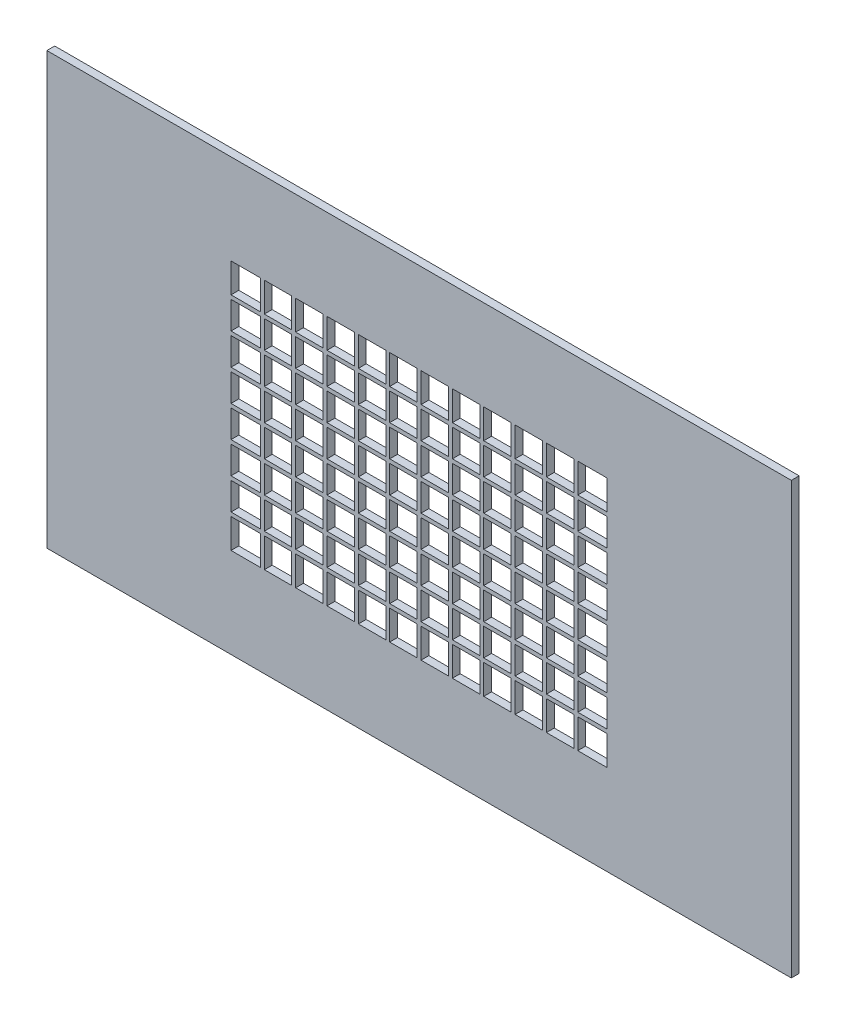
SolidWorks part; units mm, degrees
ref_plane "Front Plane" through (0, 0, 0) normal (0, 0, 1) x (1, 0, 0)
ref_plane "Top Plane" through (0, 0, 0) normal (0, 1, 0) x (1, 0, 0)
ref_plane "Right Plane" through (0, 0, 0) normal (1, 0, 0) x (0, 0, -1)
sketch "Sketch2" plane through (0, 0, 0) normal (0, 0, 1) x (1, 0, 0)
  line L1 (-237.5, -137.5) -> (237.5, -137.5)
  line L2 (-237.5, -137.5) -> (-237.5, 137.5)
  line L3 (-237.5, 137.5) -> (237.5, 137.5)
  line L4 (237.5, -137.5) -> (237.5, 137.5)
  line L5 (0, 137.5) -> (0, -137.5) construction
  line L6 (-237.5, 0) -> (237.5, 0) construction
  point P0 (0, 0)
  dimension "D1" = 275
  dimension "D2" = 475
extrude "Boss-Extrude1" add sketch "Sketch2" along normal blind 5
sketch "Sketch3" plane through (0, 0, 5) normal (0, 0, 1) x (1, 0, 0)
  line L0 (20, 80) -> (20, -80)
  line L1 (-120, -80) -> (120, -80)
  line L2 (-120, -80) -> (-120, 80)
  line L3 (-120, 80) -> (120, 80)
  line L4 (120, -80) -> (120, 80)
  line L5 (0, 80) -> (0, -80)
  line L6 (-120, 0) -> (120, 0)
  line L7 (40, 80) -> (40, -80)
  line L8 (60, 80) -> (60, -80)
  line L9 (80, 80) -> (80, -80)
  line L10 (100, 80) -> (100, -80)
  line L11 (-20, 80) -> (-20, -80)
  line L12 (-40, 80) -> (-40, -80)
  line L13 (-60, 80) -> (-60, -80)
  line L14 (-80, 80) -> (-80, -80)
  line L15 (-100, 80) -> (-100, -80)
  line L16 (-120, 20) -> (120, 20)
  line L17 (-120, 40) -> (120, 40)
  line L18 (-120, 60) -> (120, 60)
  line L19 (-120, -20) -> (120, -20)
  line L20 (-120, -40) -> (120, -40)
  line L21 (-120, -60) -> (120, -60)
  point P0 (0, 0)
  dimension "D5" = 160
  dimension "D6" = 240
  dimension "D7" = 20
  dimension "D8" = 20
  dimension "D9" = 20
  dimension "D10" = 20
  dimension "D1" = 6
  dimension "D2" = 6
  dimension "D3" = 4
  dimension "D4" = 4
other "Vent1" parameters "RibsDepth"=5, "RibsWidth"=2.5, "RibsOffset"=0, "D4"=1, "D5"=2, "D6"=0, "D7"=1, "D8"=0, "Draft"=1
